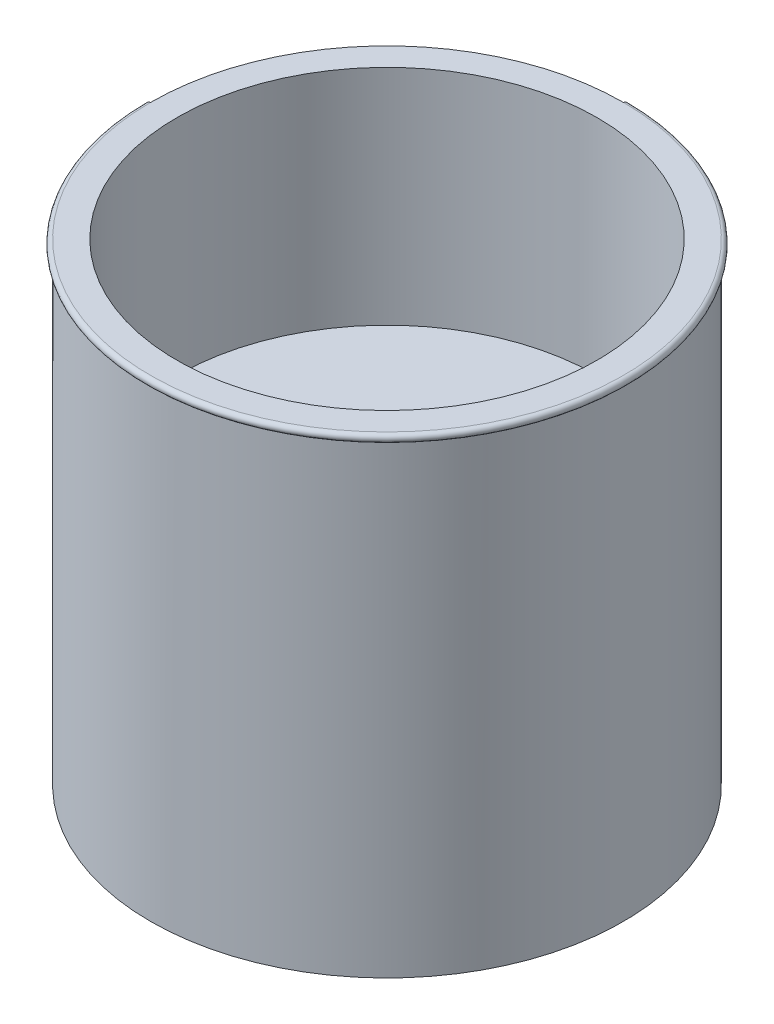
SolidWorks part; units mm, degrees
ref_plane "Front Plane" through (0, 0, 0) normal (0, 0, 1) x (1, 0, 0)
ref_plane "Top Plane" through (0, 0, 0) normal (0, 1, 0) x (1, 0, 0)
ref_plane "Right Plane" through (0, 0, 0) normal (1, 0, 0) x (0, 0, -1)
sketch "Sketch1" plane through (0, 0, 0) normal (0, 0, 1) x (1, 0, 0)
  line L0 (0, 0) -> (0, 74.4885) construction
  line L1 (0, 0) -> (-228.6, 0) construction
  line L2 (-228.6, 228.6) -> (-228.6, -228.6)
  line L3 (-228.6, 228.6) -> (-203.2, 228.6)
  line L4 (-203.2, 228.6) -> (-203.2, 12.7)
  line L5 (-203.2, 12.7) -> (0, 12.7)
  line L6 (-203.2, -12.7) -> (0, -12.7)
  line L7 (0, -12.7) -> (0, 12.7)
  line L12 (-203.2, -228.6) -> (-203.2, -12.7)
  line L13 (-228.6, -228.6) -> (-203.2, -228.6)
  point P9 (0, 12.7)
  point P18 (0, -12.7)
  dimension "D1" = 25.4
  dimension "D2" = 25.4
  dimension "D3" = 228.6
  dimension "D4" = 457.2
revolve "Revolve2" add sketch "Sketch1" angle 360 about L0
sketch "Sketch2" plane through (0, 0, 0) normal (0, 0, 1) x (1, 0, 0)
  line L1 (-228.6, 228.6) -> (-228.6, -228.6) construction
  line L2 (228.6, 228.6) -> (-228.6, 228.6) construction
  circle A0 centre (-228.6, 224.6312) radius 3.9688
  dimension "D1" = 7.9375
ref_plane "Plane1" through (0, 224.6312, 0) normal (0, 1, 0) x (-1, 0, 0)
sketch "Sketch3" plane through (0, 224.6312, 0) normal (0, 1, 0) x (-1, 0, 0)
  line L0 (0, -232.5688) -> (0, 0) construction
  line L1 (232.5688, 0) -> (0, 0) construction
  arc A0 (232.5688, 0) -> (0, -232.5688) centre (0, 0) ccw
  circle A1 centre (0, 0) radius 228.6 construction
  dimension "D1" = 3.9688
  dimension "D2" = 90
sweep "Sweep1" add profiles "Sketch2" path "Sketch3"
